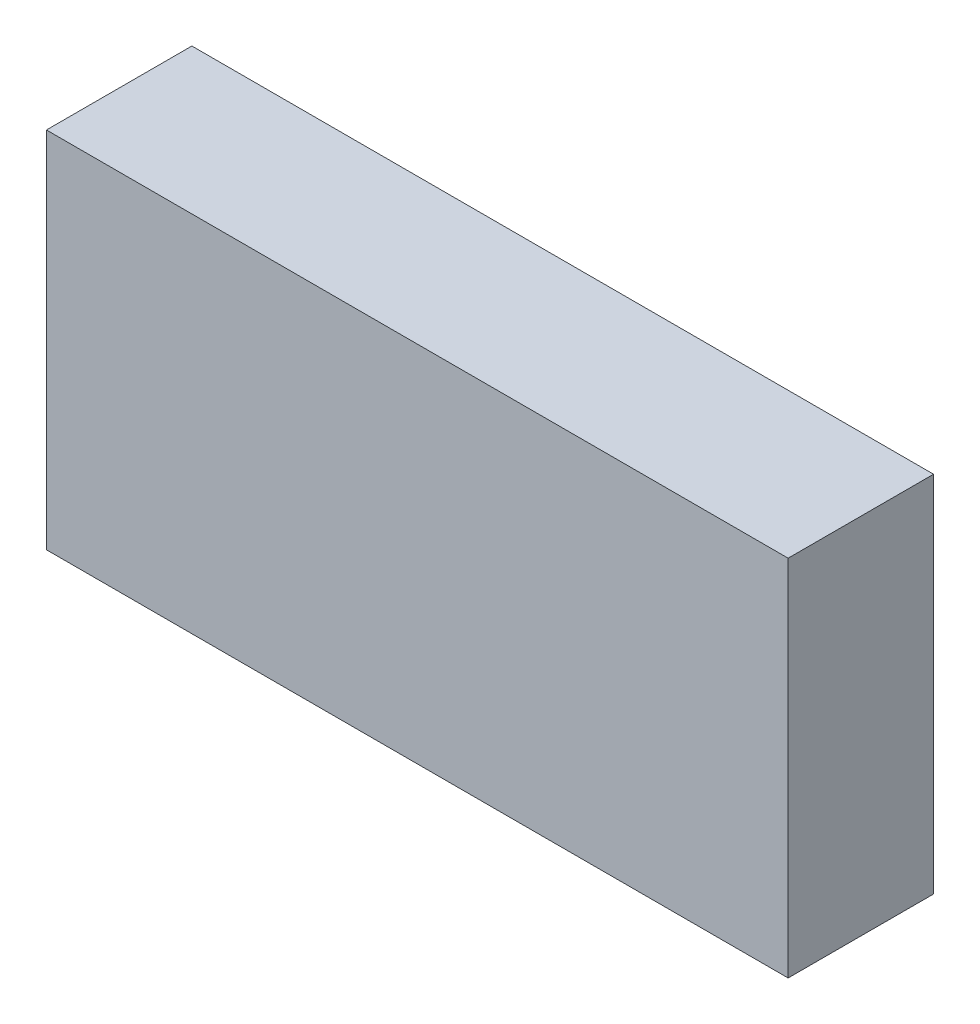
SolidWorks part; units mm, degrees
ref_plane "Alzado" through (0, 0, 0) normal (0, 0, 1) x (1, 0, 0)
ref_plane "Planta" through (0, 0, 0) normal (0, 1, 0) x (1, 0, 0)
ref_plane "Vista lateral" through (0, 0, 0) normal (1, 0, 0) x (0, 0, -1)
sketch "Croquis1" plane through (0, 0, 0) normal (0, 0, 1) x (1, 0, 0)
  line L0 (-19.5, -6.5) -> (19.5, 6.5) construction
  line L5 (-19.5, 6.5) -> (19.5, 6.5)
  line L6 (-19.5, 6.5) -> (-19.5, -6.5)
  line L7 (-19.5, -6.5) -> (19.5, -6.5)
  line L8 (19.5, 6.5) -> (19.5, -6.5)
  line L9 (25.5, -12.5) -> (-25.5, -12.5)
  line L10 (25.5, -12.5) -> (25.5, 12.5)
  line L11 (25.5, 12.5) -> (-25.5, 12.5)
  line L12 (-25.5, -12.5) -> (-25.5, 12.5)
  line L13 (0, 12.5) -> (0, -12.5) construction
  line L14 (25.5, 0) -> (-25.5, 0) construction
  line L15 (-19.5, 6.5) -> (19.5, -6.5) construction
  point P0 (0, 0)
  point P8 (0, 0)
  dimension "D1" = 6
  dimension "D2" = 39
  dimension "D3" = 6
  dimension "D4" = 13
extrude "Saliente-Extruir1" add sketch "Croquis1" along normal blind 6.5
sketch "Croquis2" plane through (25.5, 0, 0) normal (1, 0, 0) x (0, 0, -1)
  line L0 (0, -12.5) -> (0, 12.5) construction
  line L1 (0, 10.5) -> (-4.5, 10.5)
  line L2 (0, 10.5) -> (0, -10.5)
  line L3 (0, -10.5) -> (-4.5, -10.5)
  line L4 (-4.5, 10.5) -> (-4.5, -10.5)
  line L5 (-6.5, -12.5) -> (-6.5, 12.5) construction
  line L6 (-6.5, 12.5) -> (0, 12.5) construction
  line L7 (-6.5, -12.5) -> (0, -12.5) construction
  dimension "D1" = 2
  dimension "D2" = 2
  dimension "D3" = 2
extrude "Cortar-Extruir1" cut sketch "Croquis2" against normal up to surface (51 mm away)
sketch "Croquis3" plane through (0, 0, 0) normal (0, 0, -1) x (-1, 0, 0)
  line L1 (-25.5, 12.5) -> (25.5, 12.5)
  line L2 (-25.5, 12.5) -> (-25.5, -12.5)
  line L3 (-25.5, -12.5) -> (25.5, -12.5)
  line L4 (25.5, 12.5) -> (25.5, -12.5)
extrude "Saliente-Extruir2" add sketch "Croquis3" along normal blind 10
sketch "Croquis4" plane through (-25.5, 0, 0) normal (-1, 0, 0) x (0, 0, 1)
  line L0 (0, -10.5) -> (0, 10.5) construction
  line L1 (-8.2, 9.75) -> (-1.5, 9.75)
  line L2 (-8.2, 9.75) -> (-8.2, -9.75)
  line L3 (-8.2, -9.75) -> (-1.5, -9.75)
  line L4 (-1.5, 9.75) -> (-1.5, -9.75)
  dimension "D1" = 6.7
  dimension "D2" = 1.5
  dimension "D3" = 19.5
  dimension "D4" = 9.75
extrude "Cortar-Extruir2" cut sketch "Croquis4" against normal blind 38
sketch "Croquis5" plane through (0, -12.5, 0) normal (0, -1, 0) x (-1, 0, 0)
  line L0 (25.5, -6.5) -> (-25.5, -6.5) construction
  line L1 (23.5, -4.5) -> (-23.5, -4.5)
  line L2 (23.5, -4.5) -> (23.5, -1.5)
  line L3 (23.5, -1.5) -> (-23.5, -1.5)
  line L4 (-23.5, -4.5) -> (-23.5, -1.5)
  line L5 (25.5, -6.5) -> (25.5, 10) construction
  line L6 (-25.5, -6.5) -> (-25.5, 10) construction
  dimension "D1" = 2
  dimension "D2" = 2
  dimension "D3" = 3
  dimension "D4" = 2
extrude "Cortar-Extruir3" cut sketch "Croquis5" against normal through all both and the other way through all
sketch "Croquis7" plane through (0, 0, 6.5) normal (0, 0, 1) x (1, 0, 0)
  line L1 (-25.5, 12.5) -> (25.5, 12.5)
  line L2 (-25.5, 12.5) -> (-25.5, -12.5)
  line L3 (-25.5, -12.5) -> (25.5, -12.5)
  line L4 (25.5, 12.5) -> (25.5, -12.5)
extrude "Cortar-Extruir4" cut sketch "Croquis7" against normal up to surface (6.5 mm away)
